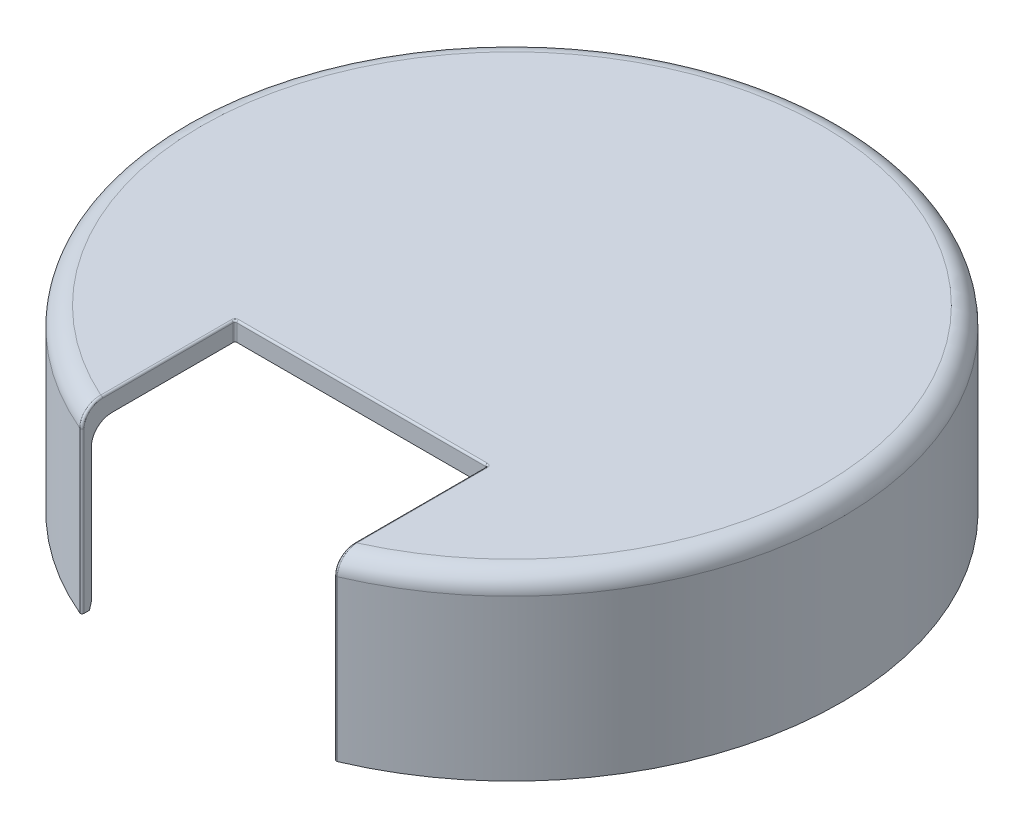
SolidWorks part; units mm, degrees
ref_plane "Front Plane" through (0, 0, 0) normal (0, 0, 1) x (1, 0, 0)
ref_plane "Top Plane" through (0, 0, 0) normal (0, 1, 0) x (1, 0, 0)
ref_plane "Right Plane" through (0, 0, 0) normal (1, 0, 0) x (0, 0, -1)
sketch "Sketch1" plane through (0, 0, 0) normal (0, 1, 0) x (1, 0, 0)
  circle A0 centre (0, 0) radius 17.5
  dimension "D1" = 35
extrude "Boss-Extrude1" add sketch "Sketch1" along normal blind 9.5
sketch "Sketch2" plane through (0, 0, 0) normal (0, -1, 0) x (1, 0, 0)
  circle A0 centre (0, 0) radius 17
  dimension "D1" = 34
extrude "Cut-Extrude1" cut sketch "Sketch2" against normal blind 8.5
fillet "Fillet1" radius 1 2 edges at (0, 9.5, 17.5) (0, 8.5, -17)
sketch "Sketch4" plane through (0, 0, 0) normal (0, 0, 1) x (1, 0, 0)
  line L0 (-17.5, 0) -> (17.5, 0) construction
  line L1 (-17.0328, 0) -> (-17.4451, 0)
  line L2 (17.4451, 1.5548) -> (16.8, 1.32)
  line L3 (16.8, 1.32) -> (17.0328, 0)
  line L6 (17.4451, 0) -> (17.4451, 1.5548)
  line L8 (17.0328, 0) -> (17.4451, 0)
  line L9 (0, 0) -> (0, 4.2931) construction
  line L10 (-17.4451, 0) -> (-17.4451, 1.5548)
  line L12 (-16.8, 1.32) -> (-17.0328, 0)
  line L13 (-17.4451, 1.5548) -> (-16.8, 1.32)
  dimension "D5" = 90
  dimension "D1" = 10
  dimension "D2" = 20
  dimension "D3" = 1.32
  dimension "D4" = 16.8
revolve "Revolve3" add sketch "Sketch4" angle 24 mid plane about L9
sketch "Sketch3" plane through (0, 9.5, 0) normal (0, 1, 0) x (1, 0, 0)
  line L1 (-6.6, -8) -> (6.6, -8)
  line L2 (-6.7, -8.1) -> (-6.7, -20.5992)
  line L3 (-6.7, -20.5992) -> (6.7, -20.5992)
  line L4 (6.7, -8.1) -> (6.7, -20.5992)
  circle A0 centre (0, 0) radius 17.5 construction
  arc A1 (6.6, -8) -> (6.7, -8.1) centre (6.6, -8.1) cw
  arc A2 (-6.6, -8) -> (-6.7, -8.1) centre (-6.6, -8.1) ccw
  dimension "D1" = 8
  dimension "D4" = 0.1
  dimension "D2" = 6.7
  dimension "D3" = 6.7
extrude "Cut-Extrude2" cut sketch "Sketch3" against normal blind 11
sketch "Sketch5" plane through (0, 9.5, 0) normal (0, 1, 0) x (1, 0, 0)
  line L1 (-9, 6) -> (9, 6)
  line L2 (-10, 5) -> (-10, -1)
  line L3 (-9, -2) -> (9, -2)
  line L4 (10, 5) -> (10, -1)
  arc A0 (9, -2) -> (10, -1) centre (9, -1) ccw
  arc A1 (10, 5) -> (9, 6) centre (9, 5) ccw
  arc A2 (-10, 5) -> (-9, 6) centre (-9, 5) cw
  arc A3 (-9, -2) -> (-10, -1) centre (-9, -1) cw
  dimension "D5" = 1
  dimension "D1" = 10
  dimension "D2" = 10
  dimension "D3" = 2
  dimension "D4" = 6
extrude "Cut-Extrude3" [suppressed] cut sketch "Sketch5" against normal blind 0.1
chamfer "Chamfer2" distance 0.1 angle 75 1 edges at (0, 0, -17)
fillet "Fillet2" radius 0.1 9 edges at (6.7, 8.9632, 16.0434) (6.7, 9.5, 11.5892) (6.6707, 9.5, 8.0293) (0, 9.5, 8) (-6.6707, 9.5, 8.0293) (-6.7, 9.5, 11.5892) (-6.7, 9.1468, 15.9094) (6.7, 4.25, 16.1666) (-6.7, 4.25, 16.1666)
sketch "Sketch6" [suppressed] plane through (0, 9.4, 0) normal (0, 1, 0) x (1, 0, 0)
  line L0 (1.1294, -0.1549) -> (1.1294, 3.8449)
  line L1 (1.1294, 3.8449) -> (2.6002, 3.8449)
  line L2 (2.6002, 3.8449) -> (2.6002, 1.1427)
  line L3 (2.6002, 1.1427) -> (4.0281, 1.1427)
  line L4 (4.0281, 1.1427) -> (4.0281, -0.1549)
  line L5 (4.0281, -0.1549) -> (1.1294, -0.1549)
  line L6 (-5.272, 1.3002) -> (-4.1097, 2.4626)
  line L7 (-4.1097, 2.4626) -> (-4.1028, 2.4704)
  line L8 (-4.1028, 2.4704) -> (-4.096, 2.4782)
  line L9 (-4.096, 2.4782) -> (-4.0892, 2.486)
  line L10 (-4.0892, 2.486) -> (-4.0834, 2.4947)
  line L11 (-4.0834, 2.4947) -> (-4.0727, 2.5122)
  line L12 (-4.0727, 2.5122) -> (-4.0639, 2.5298)
  line L13 (-4.0639, 2.5298) -> (-4.0571, 2.5482)
  line L14 (-4.0571, 2.5482) -> (-4.0523, 2.5667)
  line L15 (-4.0523, 2.5667) -> (-4.0484, 2.5862)
  line L16 (-4.0484, 2.5862) -> (-4.0474, 2.6047)
  line L17 (-4.0474, 2.6047) -> (-4.0474, 2.6241)
  line L18 (-4.0474, 2.6241) -> (-4.0493, 2.6426)
  line L19 (-4.0493, 2.6426) -> (-4.0532, 2.6611)
  line L20 (-4.0532, 2.6611) -> (-4.0591, 2.6786)
  line L21 (-4.0591, 2.6786) -> (-4.063, 2.6873)
  line L22 (-4.063, 2.6873) -> (-4.0669, 2.6961)
  line L23 (-4.0669, 2.6961) -> (-4.0717, 2.7048)
  line L24 (-4.0717, 2.7048) -> (-4.0766, 2.7126)
  line L25 (-4.0766, 2.7126) -> (-4.0814, 2.7204)
  line L26 (-4.0814, 2.7204) -> (-4.0873, 2.7282)
  line L27 (-4.0873, 2.7282) -> (-4.0941, 2.736)
  line L28 (-4.0941, 2.736) -> (-4.1009, 2.7428)
  line L29 (-4.1009, 2.7428) -> (-4.1272, 2.77)
  line L30 (-4.1272, 2.77) -> (-4.134, 2.7768)
  line L31 (-4.134, 2.7768) -> (-4.1418, 2.7827)
  line L32 (-4.1418, 2.7827) -> (-4.1495, 2.7885)
  line L33 (-4.1495, 2.7885) -> (-4.1573, 2.7943)
  line L34 (-4.1573, 2.7943) -> (-4.1661, 2.7992)
  line L35 (-4.1661, 2.7992) -> (-4.1739, 2.8031)
  line L36 (-4.1739, 2.8031) -> (-4.1826, 2.807)
  line L37 (-4.1826, 2.807) -> (-4.1914, 2.8109)
  line L38 (-4.1914, 2.8109) -> (-4.2089, 2.8167)
  line L39 (-4.2089, 2.8167) -> (-4.2274, 2.8206)
  line L40 (-4.2274, 2.8206) -> (-4.2468, 2.8225)
  line L41 (-4.2468, 2.8225) -> (-4.2653, 2.8235)
  line L42 (-4.2653, 2.8235) -> (-4.2847, 2.8216)
  line L43 (-4.2847, 2.8216) -> (-4.3032, 2.8187)
  line L44 (-4.3032, 2.8187) -> (-4.3227, 2.8128)
  line L45 (-4.3227, 2.8128) -> (-4.3402, 2.806)
  line L46 (-4.3402, 2.806) -> (-4.3587, 2.7973)
  line L47 (-4.3587, 2.7973) -> (-4.3752, 2.7866)
  line L48 (-4.3752, 2.7866) -> (-4.384, 2.7807)
  line L49 (-4.384, 2.7807) -> (-4.3917, 2.7749)
  line L50 (-4.3917, 2.7749) -> (-4.3995, 2.7681)
  line L51 (-4.3995, 2.7681) -> (-4.4073, 2.7603)
  line L52 (-4.4073, 2.7603) -> (-4.6155, 2.5531)
  line L53 (-4.6155, 2.5531) -> (-5.0104, 2.948)
  line L54 (-5.0104, 2.948) -> (-5.023, 2.9607)
  line L55 (-5.023, 2.9607) -> (-5.0357, 2.9743)
  line L56 (-5.0357, 2.9743) -> (-5.0863, 3.0219)
  line L57 (-5.0863, 3.0219) -> (-5.1378, 3.0667)
  line L58 (-5.1378, 3.0667) -> (-5.1923, 3.1085)
  line L59 (-5.1923, 3.1085) -> (-5.2477, 3.1465)
  line L60 (-5.2477, 3.1465) -> (-5.3041, 3.1824)
  line L61 (-5.3041, 3.1824) -> (-5.3625, 3.2145)
  line L62 (-5.3625, 3.2145) -> (-5.4218, 3.2437)
  line L63 (-5.4218, 3.2437) -> (-5.4822, 3.27)
  line L64 (-5.4822, 3.27) -> (-5.5444, 3.2933)
  line L65 (-5.5444, 3.2933) -> (-5.6067, 3.3138)
  line L66 (-5.6067, 3.3138) -> (-5.6689, 3.3303)
  line L67 (-5.6689, 3.3303) -> (-5.7331, 3.3439)
  line L68 (-5.7331, 3.3439) -> (-5.7973, 3.3556)
  line L69 (-5.7973, 3.3556) -> (-5.8615, 3.3634)
  line L70 (-5.8615, 3.3634) -> (-5.9267, 3.3673)
  line L71 (-5.9267, 3.3673) -> (-5.9919, 3.3692)
  line L72 (-5.9919, 3.3692) -> (-6.0561, 3.3673)
  line L73 (-6.0561, 3.3673) -> (-6.1212, 3.3634)
  line L74 (-6.1212, 3.3634) -> (-6.1854, 3.3556)
  line L75 (-6.1854, 3.3556) -> (-6.2496, 3.3449)
  line L76 (-6.2496, 3.3449) -> (-6.3138, 3.3313)
  line L77 (-6.3138, 3.3313) -> (-6.3771, 3.3138)
  line L78 (-6.3771, 3.3138) -> (-6.4393, 3.2943)
  line L79 (-6.4393, 3.2943) -> (-6.5006, 3.271)
  line L80 (-6.5006, 3.271) -> (-6.5609, 3.2447)
  line L81 (-6.5609, 3.2447) -> (-6.6202, 3.2155)
  line L82 (-6.6202, 3.2155) -> (-6.6786, 3.1834)
  line L83 (-6.6786, 3.1834) -> (-6.736, 3.1484)
  line L84 (-6.736, 3.1484) -> (-6.7914, 3.1095)
  line L85 (-6.7914, 3.1095) -> (-6.8449, 3.0677)
  line L86 (-6.8449, 3.0677) -> (-6.8975, 3.0229)
  line L87 (-6.8975, 3.0229) -> (-6.9471, 2.9753)
  line L88 (-6.9471, 2.9753) -> (-6.9957, 2.9257)
  line L89 (-6.9957, 2.9257) -> (-7.0395, 2.8731)
  line L90 (-7.0395, 2.8731) -> (-7.0813, 2.8196)
  line L91 (-7.0813, 2.8196) -> (-7.1202, 2.7642)
  line L92 (-7.1202, 2.7642) -> (-7.1552, 2.7068)
  line L93 (-7.1552, 2.7068) -> (-7.1873, 2.6484)
  line L94 (-7.1873, 2.6484) -> (-7.2165, 2.5891)
  line L95 (-7.2165, 2.5891) -> (-7.2428, 2.5288)
  line L96 (-7.2428, 2.5288) -> (-7.2661, 2.4675)
  line L97 (-7.2661, 2.4675) -> (-7.2856, 2.4043)
  line L98 (-7.2856, 2.4043) -> (-7.3031, 2.342)
  line L99 (-7.3031, 2.342) -> (-7.3167, 2.2778)
  line L100 (-7.3167, 2.2778) -> (-7.3274, 2.2136)
  line L101 (-7.3274, 2.2136) -> (-7.3352, 2.1494)
  line L102 (-7.3352, 2.1494) -> (-7.34, 2.0842)
  line L103 (-7.34, 2.0842) -> (-7.341, 2.0191)
  line L104 (-7.341, 2.0191) -> (-7.3391, 1.9549)
  line L105 (-7.3391, 1.9549) -> (-7.3352, 1.8897)
  line L106 (-7.3352, 1.8897) -> (-7.3274, 1.8255)
  line L107 (-7.3274, 1.8255) -> (-7.3157, 1.7613)
  line L108 (-7.3157, 1.7613) -> (-7.3021, 1.6971)
  line L109 (-7.3021, 1.6971) -> (-7.2856, 1.6339)
  line L110 (-7.2856, 1.6339) -> (-7.2651, 1.5716)
  line L111 (-7.2651, 1.5716) -> (-7.2418, 1.5103)
  line L112 (-7.2418, 1.5103) -> (-7.2155, 1.45)
  line L113 (-7.2155, 1.45) -> (-7.1864, 1.3907)
  line L114 (-7.1864, 1.3907) -> (-7.1543, 1.3323)
  line L115 (-7.1543, 1.3323) -> (-7.1183, 1.2759)
  line L116 (-7.1183, 1.2759) -> (-7.0803, 1.2205)
  line L117 (-7.0803, 1.2205) -> (-7.0385, 1.166)
  line L118 (-7.0385, 1.166) -> (-6.9938, 1.1144)
  line L119 (-6.9938, 1.1144) -> (-6.9461, 1.0639)
  line L120 (-6.9461, 1.0639) -> (-6.9325, 1.0512)
  line L121 (-6.9325, 1.0512) -> (-6.9198, 1.0386)
  line L122 (-6.9198, 1.0386) -> (-6.5249, 0.6437)
  line L123 (-6.5249, 0.6437) -> (-6.7331, 0.4355)
  line L124 (-6.7331, 0.4355) -> (-6.7399, 0.4277)
  line L125 (-6.7399, 0.4277) -> (-6.7467, 0.4199)
  line L126 (-6.7467, 0.4199) -> (-6.7525, 0.4121)
  line L127 (-6.7525, 0.4121) -> (-6.7593, 0.4034)
  line L128 (-6.7593, 0.4034) -> (-6.7691, 0.3869)
  line L129 (-6.7691, 0.3869) -> (-6.7778, 0.3684)
  line L130 (-6.7778, 0.3684) -> (-6.7846, 0.3499)
  line L131 (-6.7846, 0.3499) -> (-6.7905, 0.3314)
  line L132 (-6.7905, 0.3314) -> (-6.7934, 0.3129)
  line L133 (-6.7934, 0.3129) -> (-6.7953, 0.2935)
  line L134 (-6.7953, 0.2935) -> (-6.7944, 0.274)
  line L135 (-6.7944, 0.274) -> (-6.7924, 0.2555)
  line L136 (-6.7924, 0.2555) -> (-6.7885, 0.2371)
  line L137 (-6.7885, 0.2371) -> (-6.7827, 0.2195)
  line L138 (-6.7827, 0.2195) -> (-6.7798, 0.2108)
  line L139 (-6.7798, 0.2108) -> (-6.7749, 0.202)
  line L140 (-6.7749, 0.202) -> (-6.771, 0.1933)
  line L141 (-6.771, 0.1933) -> (-6.7661, 0.1855)
  line L142 (-6.7661, 0.1855) -> (-6.7603, 0.1777)
  line L143 (-6.7603, 0.1777) -> (-6.7545, 0.1699)
  line L144 (-6.7545, 0.1699) -> (-6.7486, 0.1622)
  line L145 (-6.7486, 0.1622) -> (-6.7418, 0.1553)
  line L146 (-6.7418, 0.1553) -> (-6.7146, 0.1281)
  line L147 (-6.7146, 0.1281) -> (-6.7078, 0.1213)
  line L148 (-6.7078, 0.1213) -> (-6.7, 0.1155)
  line L149 (-6.7, 0.1155) -> (-6.6922, 0.1096)
  line L150 (-6.6922, 0.1096) -> (-6.6844, 0.1038)
  line L151 (-6.6844, 0.1038) -> (-6.6767, 0.0989)
  line L152 (-6.6767, 0.0989) -> (-6.6679, 0.095)
  line L153 (-6.6679, 0.095) -> (-6.6601, 0.0911)
  line L154 (-6.6601, 0.0911) -> (-6.6504, 0.0873)
  line L155 (-6.6504, 0.0873) -> (-6.6329, 0.0814)
  line L156 (-6.6329, 0.0814) -> (-6.6144, 0.0775)
  line L157 (-6.6144, 0.0775) -> (-6.5959, 0.0756)
  line L158 (-6.5959, 0.0756) -> (-6.5765, 0.0756)
  line L159 (-6.5765, 0.0756) -> (-6.558, 0.0766)
  line L160 (-6.558, 0.0766) -> (-6.5385, 0.0804)
  line L161 (-6.5385, 0.0804) -> (-6.52, 0.0853)
  line L162 (-6.52, 0.0853) -> (-6.5016, 0.0921)
  line L163 (-6.5016, 0.0921) -> (-6.4841, 0.1009)
  line L164 (-6.4841, 0.1009) -> (-6.4665, 0.1116)
  line L165 (-6.4665, 0.1116) -> (-6.4588, 0.1174)
  line L166 (-6.4588, 0.1174) -> (-6.45, 0.1232)
  line L167 (-6.45, 0.1232) -> (-6.4422, 0.1301)
  line L168 (-6.4422, 0.1301) -> (-6.4344, 0.1378)
  line L169 (-6.4344, 0.1378) -> (-5.272, 1.3002)
  line L170 (-7.6163, 3.8449) -> (-4.0163, 3.8449)
  line L171 (-4.0163, 3.8449) -> (-4.0065, 3.8449)
  line L172 (-4.0065, 3.8449) -> (-3.9958, 3.8439)
  line L173 (-3.9958, 3.8439) -> (-3.9861, 3.8429)
  line L174 (-3.9861, 3.8429) -> (-3.9764, 3.841)
  line L175 (-3.9764, 3.841) -> (-3.9569, 3.8361)
  line L176 (-3.9569, 3.8361) -> (-3.9394, 3.8293)
  line L177 (-3.9394, 3.8293) -> (-3.9219, 3.8206)
  line L178 (-3.9219, 3.8206) -> (-3.9054, 3.8108)
  line L179 (-3.9054, 3.8108) -> (-3.8898, 3.7992)
  line L180 (-3.8898, 3.7992) -> (-3.8752, 3.7865)
  line L181 (-3.8752, 3.7865) -> (-3.8626, 3.7719)
  line L182 (-3.8626, 3.7719) -> (-3.8509, 3.7564)
  line L183 (-3.8509, 3.7564) -> (-3.8412, 3.7398)
  line L184 (-3.8412, 3.7398) -> (-3.8324, 3.7223)
  line L185 (-3.8324, 3.7223) -> (-3.8256, 3.7038)
  line L186 (-3.8256, 3.7038) -> (-3.8208, 3.6853)
  line L187 (-3.8208, 3.6853) -> (-3.8188, 3.6756)
  line L188 (-3.8188, 3.6756) -> (-3.8178, 3.6649)
  line L189 (-3.8178, 3.6649) -> (-3.8169, 3.6552)
  line L190 (-3.8169, 3.6552) -> (-3.8169, 3.6445)
  line L191 (-3.8169, 3.6445) -> (-3.8169, 0.0445)
  line L192 (-3.8169, 0.0445) -> (-3.8169, 0.0347)
  line L193 (-3.8169, 0.0347) -> (-3.8178, 0.024)
  line L194 (-3.8178, 0.024) -> (-3.8188, 0.0143)
  line L195 (-3.8188, 0.0143) -> (-3.8208, 0.0046)
  line L196 (-3.8208, 0.0046) -> (-3.8227, -0.0051)
  line L197 (-3.8227, -0.0051) -> (-3.8256, -0.0149)
  line L198 (-3.8256, -0.0149) -> (-3.8285, -0.0236)
  line L199 (-3.8285, -0.0236) -> (-3.8324, -0.0334)
  line L200 (-3.8324, -0.0334) -> (-3.8412, -0.0509)
  line L201 (-3.8412, -0.0509) -> (-3.8509, -0.0674)
  line L202 (-3.8509, -0.0674) -> (-3.8626, -0.082)
  line L203 (-3.8626, -0.082) -> (-3.8752, -0.0966)
  line L204 (-3.8752, -0.0966) -> (-3.8898, -0.1092)
  line L205 (-3.8898, -0.1092) -> (-3.9054, -0.1209)
  line L206 (-3.9054, -0.1209) -> (-3.9219, -0.1316)
  line L207 (-3.9219, -0.1316) -> (-3.9394, -0.1394)
  line L208 (-3.9394, -0.1394) -> (-3.9482, -0.1433)
  line L209 (-3.9482, -0.1433) -> (-3.9569, -0.1462)
  line L210 (-3.9569, -0.1462) -> (-3.9667, -0.1491)
  line L211 (-3.9667, -0.1491) -> (-3.9764, -0.1511)
  line L212 (-3.9764, -0.1511) -> (-3.9861, -0.153)
  line L213 (-3.9861, -0.153) -> (-3.9958, -0.154)
  line L214 (-3.9958, -0.154) -> (-4.0065, -0.1549)
  line L215 (-4.0065, -0.1549) -> (-4.0163, -0.1549)
  line L216 (-4.0163, -0.1549) -> (-7.6163, -0.1549)
  line L217 (-7.6163, -0.1549) -> (-7.627, -0.1549)
  line L218 (-7.627, -0.1549) -> (-7.6367, -0.154)
  line L219 (-7.6367, -0.154) -> (-7.6474, -0.153)
  line L220 (-7.6474, -0.153) -> (-7.6572, -0.1511)
  line L221 (-7.6572, -0.1511) -> (-7.6669, -0.1491)
  line L222 (-7.6669, -0.1491) -> (-7.6756, -0.1462)
  line L223 (-7.6756, -0.1462) -> (-7.6854, -0.1433)
  line L224 (-7.6854, -0.1433) -> (-7.6941, -0.1394)
  line L225 (-7.6941, -0.1394) -> (-7.7116, -0.1316)
  line L226 (-7.7116, -0.1316) -> (-7.7282, -0.1209)
  line L227 (-7.7282, -0.1209) -> (-7.7437, -0.1092)
  line L228 (-7.7437, -0.1092) -> (-7.7583, -0.0966)
  line L229 (-7.7583, -0.0966) -> (-7.771, -0.082)
  line L230 (-7.771, -0.082) -> (-7.7826, -0.0674)
  line L231 (-7.7826, -0.0674) -> (-7.7924, -0.0509)
  line L232 (-7.7924, -0.0509) -> (-7.8011, -0.0334)
  line L233 (-7.8011, -0.0334) -> (-7.805, -0.0236)
  line L234 (-7.805, -0.0236) -> (-7.8079, -0.0149)
  line L235 (-7.8079, -0.0149) -> (-7.8108, -0.0051)
  line L236 (-7.8108, -0.0051) -> (-7.8128, 0.0046)
  line L237 (-7.8128, 0.0046) -> (-7.8147, 0.0143)
  line L238 (-7.8147, 0.0143) -> (-7.8157, 0.024)
  line L239 (-7.8157, 0.024) -> (-7.8167, 0.0347)
  line L240 (-7.8167, 0.0347) -> (-7.8167, 0.0445)
  line L241 (-7.8167, 0.0445) -> (-7.8167, 3.6445)
  line L242 (-7.8167, 3.6445) -> (-7.8167, 3.6552)
  line L243 (-7.8167, 3.6552) -> (-7.8157, 3.6649)
  line L244 (-7.8157, 3.6649) -> (-7.8147, 3.6756)
  line L245 (-7.8147, 3.6756) -> (-7.8128, 3.6853)
  line L246 (-7.8128, 3.6853) -> (-7.8108, 3.6951)
  line L247 (-7.8108, 3.6951) -> (-7.8079, 3.7038)
  line L248 (-7.8079, 3.7038) -> (-7.805, 3.7136)
  line L249 (-7.805, 3.7136) -> (-7.8011, 3.7223)
  line L250 (-7.8011, 3.7223) -> (-7.7924, 3.7398)
  line L251 (-7.7924, 3.7398) -> (-7.7826, 3.7564)
  line L252 (-7.7826, 3.7564) -> (-7.771, 3.7719)
  line L253 (-7.771, 3.7719) -> (-7.7583, 3.7865)
  line L254 (-7.7583, 3.7865) -> (-7.7437, 3.7992)
  line L255 (-7.7437, 3.7992) -> (-7.7282, 3.8108)
  line L256 (-7.7282, 3.8108) -> (-7.7116, 3.8206)
  line L257 (-7.7116, 3.8206) -> (-7.6941, 3.8293)
  line L258 (-7.6941, 3.8293) -> (-7.6854, 3.8322)
  line L259 (-7.6854, 3.8322) -> (-7.6756, 3.8361)
  line L260 (-7.6756, 3.8361) -> (-7.6669, 3.8381)
  line L261 (-7.6669, 3.8381) -> (-7.6572, 3.841)
  line L262 (-7.6572, 3.841) -> (-7.6474, 3.8429)
  line L263 (-7.6474, 3.8429) -> (-7.6367, 3.8439)
  line L264 (-7.6367, 3.8439) -> (-7.627, 3.8449)
  line L265 (-7.627, 3.8449) -> (-7.6163, 3.8449)
  line L266 (-2.9599, -0.1549) -> (-2.9599, 3.8449)
  line L267 (-2.9599, 3.8449) -> (-1.1127, 3.8449)
  line L268 (-1.1127, 3.8449) -> (-1.0631, 3.8449)
  line L269 (-1.0631, 3.8449) -> (-1.0135, 3.8439)
  line L270 (-1.0135, 3.8439) -> (-0.9649, 3.842)
  line L271 (-0.9649, 3.842) -> (-0.9172, 3.839)
  line L272 (-0.9172, 3.839) -> (-0.8705, 3.8361)
  line L273 (-0.8705, 3.8361) -> (-0.8248, 3.8322)
  line L274 (-0.8248, 3.8322) -> (-0.7791, 3.8283)
  line L275 (-0.7791, 3.8283) -> (-0.7343, 3.8235)
  line L276 (-0.7343, 3.8235) -> (-0.6905, 3.8176)
  line L277 (-0.6905, 3.8176) -> (-0.6477, 3.8108)
  line L278 (-0.6477, 3.8108) -> (-0.6049, 3.804)
  line L279 (-0.6049, 3.804) -> (-0.5631, 3.7962)
  line L280 (-0.5631, 3.7962) -> (-0.5223, 3.7875)
  line L281 (-0.5223, 3.7875) -> (-0.4824, 3.7787)
  line L282 (-0.4824, 3.7787) -> (-0.4425, 3.769)
  line L283 (-0.4425, 3.769) -> (-0.4046, 3.7583)
  line L284 (-0.4046, 3.7583) -> (-0.3666, 3.7466)
  line L285 (-0.3666, 3.7466) -> (-0.3287, 3.735)
  line L286 (-0.3287, 3.735) -> (-0.2927, 3.7223)
  line L287 (-0.2927, 3.7223) -> (-0.2567, 3.7097)
  line L288 (-0.2567, 3.7097) -> (-0.2217, 3.6951)
  line L289 (-0.2217, 3.6951) -> (-0.1877, 3.6805)
  line L290 (-0.1877, 3.6805) -> (-0.1536, 3.6659)
  line L291 (-0.1536, 3.6659) -> (-0.1205, 3.6494)
  line L292 (-0.1205, 3.6494) -> (-0.0884, 3.6328)
  line L293 (-0.0884, 3.6328) -> (-0.0573, 3.6153)
  line L294 (-0.0573, 3.6153) -> (-0.0272, 3.5978)
  line L295 (-0.0272, 3.5978) -> (0.003, 3.5793)
  line L296 (0.003, 3.5793) -> (0.0322, 3.5599)
  line L297 (0.0322, 3.5599) -> (0.0604, 3.5394)
  line L298 (0.0604, 3.5394) -> (0.0876, 3.519)
  line L299 (0.0876, 3.519) -> (0.1149, 3.4976)
  line L300 (0.1149, 3.4976) -> (0.1411, 3.4762)
  line L301 (0.1411, 3.4762) -> (0.1664, 3.4529)
  line L302 (0.1664, 3.4529) -> (0.1907, 3.4305)
  line L303 (0.1907, 3.4305) -> (0.2141, 3.4062)
  line L304 (0.2141, 3.4062) -> (0.2374, 3.3819)
  line L305 (0.2374, 3.3819) -> (0.2588, 3.3566)
  line L306 (0.2588, 3.3566) -> (0.2802, 3.3313)
  line L307 (0.2802, 3.3313) -> (0.3007, 3.305)
  line L308 (0.3007, 3.305) -> (0.3201, 3.2787)
  line L309 (0.3201, 3.2787) -> (0.3386, 3.2505)
  line L310 (0.3386, 3.2505) -> (0.3561, 3.2233)
  line L311 (0.3561, 3.2233) -> (0.3736, 3.1941)
  line L312 (0.3736, 3.1941) -> (0.3892, 3.1649)
  line L313 (0.3892, 3.1649) -> (0.4047, 3.1358)
  line L314 (0.4047, 3.1358) -> (0.4193, 3.1056)
  line L315 (0.4193, 3.1056) -> (0.4329, 3.0745)
  line L316 (0.4329, 3.0745) -> (0.4456, 3.0424)
  line L317 (0.4456, 3.0424) -> (0.4573, 3.0103)
  line L318 (0.4573, 3.0103) -> (0.4689, 2.9782)
  line L319 (0.4689, 2.9782) -> (0.4787, 2.9441)
  line L320 (0.4787, 2.9441) -> (0.4884, 2.9101)
  line L321 (0.4884, 2.9101) -> (0.4971, 2.876)
  line L322 (0.4971, 2.876) -> (0.5049, 2.841)
  line L323 (0.5049, 2.841) -> (0.5117, 2.805)
  line L324 (0.5117, 2.805) -> (0.5185, 2.769)
  line L325 (0.5185, 2.769) -> (0.5234, 2.7321)
  line L326 (0.5234, 2.7321) -> (0.5283, 2.6941)
  line L327 (0.5283, 2.6941) -> (0.5322, 2.6562)
  line L328 (0.5322, 2.6562) -> (0.5351, 2.6173)
  line L329 (0.5351, 2.6173) -> (0.537, 2.5784)
  line L330 (0.537, 2.5784) -> (0.538, 2.5385)
  line L331 (0.538, 2.5385) -> (0.539, 2.4977)
  line L332 (0.539, 2.4977) -> (0.538, 2.4451)
  line L333 (0.538, 2.4451) -> (0.5351, 2.3936)
  line L334 (0.5351, 2.3936) -> (0.5312, 2.343)
  line L335 (0.5312, 2.343) -> (0.5254, 2.2944)
  line L336 (0.5254, 2.2944) -> (0.5176, 2.2457)
  line L337 (0.5176, 2.2457) -> (0.5088, 2.199)
  line L338 (0.5088, 2.199) -> (0.4971, 2.1533)
  line L339 (0.4971, 2.1533) -> (0.4855, 2.1095)
  line L340 (0.4855, 2.1095) -> (0.4709, 2.0658)
  line L341 (0.4709, 2.0658) -> (0.4553, 2.0239)
  line L342 (0.4553, 2.0239) -> (0.4466, 2.0035)
  line L343 (0.4466, 2.0035) -> (0.4378, 1.9831)
  line L344 (0.4378, 1.9831) -> (0.4281, 1.9627)
  line L345 (0.4281, 1.9627) -> (0.4184, 1.9432)
  line L346 (0.4184, 1.9432) -> (0.4086, 1.9238)
  line L347 (0.4086, 1.9238) -> (0.3979, 1.9043)
  line L348 (0.3979, 1.9043) -> (0.3863, 1.8858)
  line L349 (0.3863, 1.8858) -> (0.3756, 1.8673)
  line L350 (0.3756, 1.8673) -> (0.3629, 1.8489)
  line L351 (0.3629, 1.8489) -> (0.3512, 1.8304)
  line L352 (0.3512, 1.8304) -> (0.3386, 1.8129)
  line L353 (0.3386, 1.8129) -> (0.325, 1.7954)
  line L354 (0.325, 1.7954) -> (0.3114, 1.7788)
  line L355 (0.3114, 1.7788) -> (0.2977, 1.7623)
  line L356 (0.2977, 1.7623) -> (0.2841, 1.7457)
  line L357 (0.2841, 1.7457) -> (0.2695, 1.7302)
  line L358 (0.2695, 1.7302) -> (0.2549, 1.7146)
  line L359 (0.2549, 1.7146) -> (0.2394, 1.7)
  line L360 (0.2394, 1.7) -> (0.2248, 1.6854)
  line L361 (0.2248, 1.6854) -> (0.2092, 1.6718)
  line L362 (0.2092, 1.6718) -> (0.1937, 1.6582)
  line L363 (0.1937, 1.6582) -> (0.1771, 1.6456)
  line L364 (0.1771, 1.6456) -> (0.1606, 1.6329)
  line L365 (0.1606, 1.6329) -> (0.144, 1.6203)
  line L366 (0.144, 1.6203) -> (0.1265, 1.6086)
  line L367 (0.1265, 1.6086) -> (0.11, 1.5979)
  line L368 (0.11, 1.5979) -> (0.0925, 1.5872)
  line L369 (0.0925, 1.5872) -> (0.074, 1.5765)
  line L370 (0.074, 1.5765) -> (0.0565, 1.5668)
  line L371 (0.0565, 1.5668) -> (0.038, 1.557)
  line L372 (0.038, 1.557) -> (0.0195, 1.5483)
  line L373 (0.0195, 1.5483) -> (0.0001, 1.5395)
  line L374 (0.0001, 1.5395) -> (-0.0194, 1.5317)
  line L375 (-0.0194, 1.5317) -> (-0.0388, 1.524)
  line L376 (-0.0388, 1.524) -> (-0.0583, 1.5172)
  line L377 (-0.0583, 1.5172) -> (-0.0787, 1.5103)
  line L378 (-0.0787, 1.5103) -> (-0.0991, 1.5045)
  line L379 (-0.0991, 1.5045) -> (-0.1205, 1.4987)
  line L380 (-0.1205, 1.4987) -> (-0.141, 1.4928)
  line L381 (-0.141, 1.4928) -> (-0.1624, 1.488)
  line L382 (-0.1624, 1.488) -> (-0.1838, 1.4841)
  line L383 (-0.1838, 1.4841) -> (-0.2061, 1.4792)
  line L384 (-0.2061, 1.4792) -> (-0.2285, 1.4763)
  line L385 (-0.2285, 1.4763) -> (-0.2509, 1.4734)
  line L386 (-0.2509, 1.4734) -> (0.8395, -0.1549)
  line L387 (0.8395, -0.1549) -> (-0.8053, -0.1549)
  line L388 (-0.8053, -0.1549) -> (-1.5203, 1.1641)
  line L389 (-1.5203, 1.1641) -> (-1.5203, -0.1549)
  line L390 (-1.5203, -0.1549) -> (-2.9599, -0.1549)
  line L391 (-1.5203, 2.8148) -> (-1.5203, 2.0337)
  line L392 (-1.5203, 2.0337) -> (-1.2917, 2.0337)
  line L393 (-1.2917, 2.0337) -> (-1.2654, 2.0337)
  line L394 (-1.2654, 2.0337) -> (-1.2401, 2.0356)
  line L395 (-1.2401, 2.0356) -> (-1.2158, 2.0376)
  line L396 (-1.2158, 2.0376) -> (-1.1925, 2.0395)
  line L397 (-1.1925, 2.0395) -> (-1.1701, 2.0434)
  line L398 (-1.1701, 2.0434) -> (-1.1477, 2.0473)
  line L399 (-1.1477, 2.0473) -> (-1.1263, 2.0531)
  line L400 (-1.1263, 2.0531) -> (-1.1059, 2.059)
  line L401 (-1.1059, 2.059) -> (-1.0864, 2.0648)
  line L402 (-1.0864, 2.0648) -> (-1.068, 2.0726)
  line L403 (-1.068, 2.0726) -> (-1.0495, 2.0813)
  line L404 (-1.0495, 2.0813) -> (-1.032, 2.0901)
  line L405 (-1.032, 2.0901) -> (-1.0154, 2.0998)
  line L406 (-1.0154, 2.0998) -> (-0.9989, 2.1105)
  line L407 (-0.9989, 2.1105) -> (-0.9843, 2.1212)
  line L408 (-0.9843, 2.1212) -> (-0.9697, 2.1329)
  line L409 (-0.9697, 2.1329) -> (-0.9561, 2.1465)
  line L410 (-0.9561, 2.1465) -> (-0.9435, 2.1591)
  line L411 (-0.9435, 2.1591) -> (-0.9308, 2.1737)
  line L412 (-0.9308, 2.1737) -> (-0.9201, 2.1883)
  line L413 (-0.9201, 2.1883) -> (-0.9104, 2.2039)
  line L414 (-0.9104, 2.2039) -> (-0.9007, 2.2204)
  line L415 (-0.9007, 2.2204) -> (-0.8919, 2.237)
  line L416 (-0.8919, 2.237) -> (-0.8851, 2.2545)
  line L417 (-0.8851, 2.2545) -> (-0.8783, 2.273)
  line L418 (-0.8783, 2.273) -> (-0.8724, 2.2914)
  line L419 (-0.8724, 2.2914) -> (-0.8676, 2.3109)
  line L420 (-0.8676, 2.3109) -> (-0.8637, 2.3313)
  line L421 (-0.8637, 2.3313) -> (-0.8608, 2.3517)
  line L422 (-0.8608, 2.3517) -> (-0.8579, 2.3731)
  line L423 (-0.8579, 2.3731) -> (-0.8569, 2.3955)
  line L424 (-0.8569, 2.3955) -> (-0.8559, 2.4189)
  line L425 (-0.8559, 2.4189) -> (-0.8569, 2.4422)
  line L426 (-0.8569, 2.4422) -> (-0.8579, 2.4656)
  line L427 (-0.8579, 2.4656) -> (-0.8608, 2.4879)
  line L428 (-0.8608, 2.4879) -> (-0.8637, 2.5093)
  line L429 (-0.8637, 2.5093) -> (-0.8676, 2.5298)
  line L430 (-0.8676, 2.5298) -> (-0.8724, 2.5502)
  line L431 (-0.8724, 2.5502) -> (-0.8783, 2.5696)
  line L432 (-0.8783, 2.5696) -> (-0.8851, 2.5881)
  line L433 (-0.8851, 2.5881) -> (-0.8919, 2.6056)
  line L434 (-0.8919, 2.6056) -> (-0.9007, 2.6231)
  line L435 (-0.9007, 2.6231) -> (-0.9104, 2.6397)
  line L436 (-0.9104, 2.6397) -> (-0.9201, 2.6562)
  line L437 (-0.9201, 2.6562) -> (-0.9308, 2.6708)
  line L438 (-0.9308, 2.6708) -> (-0.9435, 2.6854)
  line L439 (-0.9435, 2.6854) -> (-0.9561, 2.699)
  line L440 (-0.9561, 2.699) -> (-0.9697, 2.7126)
  line L441 (-0.9697, 2.7126) -> (-0.9843, 2.7253)
  line L442 (-0.9843, 2.7253) -> (-0.9989, 2.7369)
  line L443 (-0.9989, 2.7369) -> (-1.0154, 2.7476)
  line L444 (-1.0154, 2.7476) -> (-1.032, 2.7574)
  line L445 (-1.032, 2.7574) -> (-1.0495, 2.7661)
  line L446 (-1.0495, 2.7661) -> (-1.068, 2.7749)
  line L447 (-1.068, 2.7749) -> (-1.0864, 2.7827)
  line L448 (-1.0864, 2.7827) -> (-1.1059, 2.7895)
  line L449 (-1.1059, 2.7895) -> (-1.1263, 2.7953)
  line L450 (-1.1263, 2.7953) -> (-1.1477, 2.8002)
  line L451 (-1.1477, 2.8002) -> (-1.1701, 2.805)
  line L452 (-1.1701, 2.805) -> (-1.1925, 2.8089)
  line L453 (-1.1925, 2.8089) -> (-1.2158, 2.8118)
  line L454 (-1.2158, 2.8118) -> (-1.2401, 2.8138)
  line L455 (-1.2401, 2.8138) -> (-1.2654, 2.8148)
  line L456 (-1.2654, 2.8148) -> (-1.2917, 2.8148)
  line L457 (-1.2917, 2.8148) -> (-1.5203, 2.8148)
  line L458 (4.3773, 0.2711) -> (4.8462, 1.3391)
  line L459 (4.8462, 1.3391) -> (4.924, 1.2895)
  line L460 (4.924, 1.2895) -> (4.9989, 1.2428)
  line L461 (4.9989, 1.2428) -> (5.0358, 1.2214)
  line L462 (5.0358, 1.2214) -> (5.0728, 1.2)
  line L463 (5.0728, 1.2) -> (5.1088, 1.1806)
  line L464 (5.1088, 1.1806) -> (5.1438, 1.1611)
  line L465 (5.1438, 1.1611) -> (5.1788, 1.1427)
  line L466 (5.1788, 1.1427) -> (5.2129, 1.1251)
  line L467 (5.2129, 1.1251) -> (5.2469, 1.1086)
  line L468 (5.2469, 1.1086) -> (5.28, 1.093)
  line L469 (5.28, 1.093) -> (5.3121, 1.0775)
  line L470 (5.3121, 1.0775) -> (5.3452, 1.0639)
  line L471 (5.3452, 1.0639) -> (5.3763, 1.0502)
  line L472 (5.3763, 1.0502) -> (5.4074, 1.0386)
  line L473 (5.4074, 1.0386) -> (5.4385, 1.0269)
  line L474 (5.4385, 1.0269) -> (5.4687, 1.0162)
  line L475 (5.4687, 1.0162) -> (5.4989, 1.0065)
  line L476 (5.4989, 1.0065) -> (5.529, 0.9968)
  line L477 (5.529, 0.9968) -> (5.5592, 0.988)
  line L478 (5.5592, 0.988) -> (5.5883, 0.9802)
  line L479 (5.5883, 0.9802) -> (5.6175, 0.9734)
  line L480 (5.6175, 0.9734) -> (5.6467, 0.9676)
  line L481 (5.6467, 0.9676) -> (5.6749, 0.9617)
  line L482 (5.6749, 0.9617) -> (5.7041, 0.9569)
  line L483 (5.7041, 0.9569) -> (5.7323, 0.953)
  line L484 (5.7323, 0.953) -> (5.7605, 0.9491)
  line L485 (5.7605, 0.9491) -> (5.7878, 0.9471)
  line L486 (5.7878, 0.9471) -> (5.815, 0.9452)
  line L487 (5.815, 0.9452) -> (5.8422, 0.9433)
  line L488 (5.8422, 0.9433) -> (5.8695, 0.9433)
  line L489 (5.8695, 0.9433) -> (5.9064, 0.9442)
  line L490 (5.9064, 0.9442) -> (5.9405, 0.9471)
  line L491 (5.9405, 0.9471) -> (5.957, 0.9481)
  line L492 (5.957, 0.9481) -> (5.9735, 0.951)
  line L493 (5.9735, 0.951) -> (5.9891, 0.954)
  line L494 (5.9891, 0.954) -> (6.0047, 0.9569)
  line L495 (6.0047, 0.9569) -> (6.0193, 0.9598)
  line L496 (6.0193, 0.9598) -> (6.0329, 0.9637)
  line L497 (6.0329, 0.9637) -> (6.0465, 0.9685)
  line L498 (6.0465, 0.9685) -> (6.0591, 0.9734)
  line L499 (6.0591, 0.9734) -> (6.0718, 0.9783)
  line L500 (6.0718, 0.9783) -> (6.0835, 0.9841)
  line L501 (6.0835, 0.9841) -> (6.0951, 0.9899)
  line L502 (6.0951, 0.9899) -> (6.1068, 0.9968)
  line L503 (6.1068, 0.9968) -> (6.1165, 1.0036)
  line L504 (6.1165, 1.0036) -> (6.1263, 1.0104)
  line L505 (6.1263, 1.0104) -> (6.136, 1.0182)
  line L506 (6.136, 1.0182) -> (6.1447, 1.0259)
  line L507 (6.1447, 1.0259) -> (6.1525, 1.0337)
  line L508 (6.1525, 1.0337) -> (6.1593, 1.0415)
  line L509 (6.1593, 1.0415) -> (6.1661, 1.0502)
  line L510 (6.1661, 1.0502) -> (6.171, 1.059)
  line L511 (6.171, 1.059) -> (6.1768, 1.0687)
  line L512 (6.1768, 1.0687) -> (6.1807, 1.0785)
  line L513 (6.1807, 1.0785) -> (6.1846, 1.0882)
  line L514 (6.1846, 1.0882) -> (6.1875, 1.0979)
  line L515 (6.1875, 1.0979) -> (6.1895, 1.1086)
  line L516 (6.1895, 1.1086) -> (6.1914, 1.1193)
  line L517 (6.1914, 1.1193) -> (6.1924, 1.13)
  line L518 (6.1924, 1.13) -> (6.1934, 1.1417)
  line L519 (6.1934, 1.1417) -> (6.1924, 1.1514)
  line L520 (6.1924, 1.1514) -> (6.1914, 1.1611)
  line L521 (6.1914, 1.1611) -> (6.1895, 1.1709)
  line L522 (6.1895, 1.1709) -> (6.1866, 1.1796)
  line L523 (6.1866, 1.1796) -> (6.1827, 1.1893)
  line L524 (6.1827, 1.1893) -> (6.1778, 1.1981)
  line L525 (6.1778, 1.1981) -> (6.172, 1.2078)
  line L526 (6.172, 1.2078) -> (6.1661, 1.2166)
  line L527 (6.1661, 1.2166) -> (6.1584, 1.2253)
  line L528 (6.1584, 1.2253) -> (6.1506, 1.2331)
  line L529 (6.1506, 1.2331) -> (6.1418, 1.2419)
  line L530 (6.1418, 1.2419) -> (6.1321, 1.2497)
  line L531 (6.1321, 1.2497) -> (6.1214, 1.2584)
  line L532 (6.1214, 1.2584) -> (6.1107, 1.2662)
  line L533 (6.1107, 1.2662) -> (6.0981, 1.274)
  line L534 (6.0981, 1.274) -> (6.0854, 1.2818)
  line L535 (6.0854, 1.2818) -> (6.0708, 1.2886)
  line L536 (6.0708, 1.2886) -> (6.0562, 1.2963)
  line L537 (6.0562, 1.2963) -> (6.0407, 1.3032)
  line L538 (6.0407, 1.3032) -> (6.0241, 1.3109)
  line L539 (6.0241, 1.3109) -> (5.9891, 1.3246)
  line L540 (5.9891, 1.3246) -> (5.9502, 1.3372)
  line L541 (5.9502, 1.3372) -> (5.9074, 1.3498)
  line L542 (5.9074, 1.3498) -> (5.8617, 1.3615)
  line L543 (5.8617, 1.3615) -> (5.813, 1.3732)
  line L544 (5.813, 1.3732) -> (5.7605, 1.3829)
  line L545 (5.7605, 1.3829) -> (5.7265, 1.3907)
  line L546 (5.7265, 1.3907) -> (5.6944, 1.3975)
  line L547 (5.6944, 1.3975) -> (5.6642, 1.4033)
  line L548 (5.6642, 1.4033) -> (5.636, 1.4092)
  line L549 (5.636, 1.4092) -> (5.6097, 1.414)
  line L550 (5.6097, 1.414) -> (5.5854, 1.4189)
  line L551 (5.5854, 1.4189) -> (5.5631, 1.4238)
  line L552 (5.5631, 1.4238) -> (5.5426, 1.4277)
  line L553 (5.5426, 1.4277) -> (5.4862, 1.4413)
  line L554 (5.4862, 1.4413) -> (5.4317, 1.4559)
  line L555 (5.4317, 1.4559) -> (5.3792, 1.4724)
  line L556 (5.3792, 1.4724) -> (5.3277, 1.4899)
  line L557 (5.3277, 1.4899) -> (5.2781, 1.5084)
  line L558 (5.2781, 1.5084) -> (5.2304, 1.5288)
  line L559 (5.2304, 1.5288) -> (5.1837, 1.5502)
  line L560 (5.1837, 1.5502) -> (5.139, 1.5726)
  line L561 (5.139, 1.5726) -> (5.1176, 1.5843)
  line L562 (5.1176, 1.5843) -> (5.0962, 1.5959)
  line L563 (5.0962, 1.5959) -> (5.0757, 1.6086)
  line L564 (5.0757, 1.6086) -> (5.0553, 1.6212)
  line L565 (5.0553, 1.6212) -> (5.0349, 1.6339)
  line L566 (5.0349, 1.6339) -> (5.0154, 1.6475)
  line L567 (5.0154, 1.6475) -> (4.996, 1.6611)
  line L568 (4.996, 1.6611) -> (4.9775, 1.6747)
  line L569 (4.9775, 1.6747) -> (4.959, 1.6893)
  line L570 (4.959, 1.6893) -> (4.9415, 1.7039)
  line L571 (4.9415, 1.7039) -> (4.924, 1.7185)
  line L572 (4.924, 1.7185) -> (4.9065, 1.7341)
  line L573 (4.9065, 1.7341) -> (4.8899, 1.7496)
  line L574 (4.8899, 1.7496) -> (4.8744, 1.7652)
  line L575 (4.8744, 1.7652) -> (4.8578, 1.7808)
  line L576 (4.8578, 1.7808) -> (4.8432, 1.7973)
  line L577 (4.8432, 1.7973) -> (4.8277, 1.8138)
  line L578 (4.8277, 1.8138) -> (4.8131, 1.8313)
  line L579 (4.8131, 1.8313) -> (4.7995, 1.8489)
  line L580 (4.7995, 1.8489) -> (4.7859, 1.8664)
  line L581 (4.7859, 1.8664) -> (4.7732, 1.8839)
  line L582 (4.7732, 1.8839) -> (4.7606, 1.9014)
  line L583 (4.7606, 1.9014) -> (4.7479, 1.9199)
  line L584 (4.7479, 1.9199) -> (4.7362, 1.9383)
  line L585 (4.7362, 1.9383) -> (4.7255, 1.9568)
  line L586 (4.7255, 1.9568) -> (4.7148, 1.9763)
  line L587 (4.7148, 1.9763) -> (4.7051, 1.9957)
  line L588 (4.7051, 1.9957) -> (4.6954, 2.0152)
  line L589 (4.6954, 2.0152) -> (4.6857, 2.0346)
  line L590 (4.6857, 2.0346) -> (4.6769, 2.0551)
  line L591 (4.6769, 2.0551) -> (4.6682, 2.0755)
  line L592 (4.6682, 2.0755) -> (4.6604, 2.0959)
  line L593 (4.6604, 2.0959) -> (4.6536, 2.1163)
  line L594 (4.6536, 2.1163) -> (4.6468, 2.1377)
  line L595 (4.6468, 2.1377) -> (4.6399, 2.1591)
  line L596 (4.6399, 2.1591) -> (4.6341, 2.1805)
  line L597 (4.6341, 2.1805) -> (4.6292, 2.2019)
  line L598 (4.6292, 2.2019) -> (4.6234, 2.2243)
  line L599 (4.6234, 2.2243) -> (4.6195, 2.2467)
  line L600 (4.6195, 2.2467) -> (4.6156, 2.2691)
  line L601 (4.6156, 2.2691) -> (4.6117, 2.2924)
  line L602 (4.6117, 2.2924) -> (4.6088, 2.3148)
  line L603 (4.6088, 2.3148) -> (4.6059, 2.3381)
  line L604 (4.6059, 2.3381) -> (4.604, 2.3624)
  line L605 (4.604, 2.3624) -> (4.602, 2.3858)
  line L606 (4.602, 2.3858) -> (4.601, 2.4101)
  line L607 (4.601, 2.4101) -> (4.6001, 2.4344)
  line L608 (4.6001, 2.4344) -> (4.6001, 2.4587)
  line L609 (4.6001, 2.4587) -> (4.601, 2.4977)
  line L610 (4.601, 2.4977) -> (4.602, 2.5346)
  line L611 (4.602, 2.5346) -> (4.604, 2.5726)
  line L612 (4.604, 2.5726) -> (4.6078, 2.6095)
  line L613 (4.6078, 2.6095) -> (4.6117, 2.6455)
  line L614 (4.6117, 2.6455) -> (4.6166, 2.6815)
  line L615 (4.6166, 2.6815) -> (4.6224, 2.7165)
  line L616 (4.6224, 2.7165) -> (4.6292, 2.7515)
  line L617 (4.6292, 2.7515) -> (4.637, 2.7866)
  line L618 (4.637, 2.7866) -> (4.6458, 2.8206)
  line L619 (4.6458, 2.8206) -> (4.6555, 2.8546)
  line L620 (4.6555, 2.8546) -> (4.6662, 2.8877)
  line L621 (4.6662, 2.8877) -> (4.6779, 2.9208)
  line L622 (4.6779, 2.9208) -> (4.6905, 2.9529)
  line L623 (4.6905, 2.9529) -> (4.7032, 2.985)
  line L624 (4.7032, 2.985) -> (4.7178, 3.0161)
  line L625 (4.7178, 3.0161) -> (4.7333, 3.0472)
  line L626 (4.7333, 3.0472) -> (4.7489, 3.0784)
  line L627 (4.7489, 3.0784) -> (4.7664, 3.1085)
  line L628 (4.7664, 3.1085) -> (4.7839, 3.1377)
  line L629 (4.7839, 3.1377) -> (4.8034, 3.1669)
  line L630 (4.8034, 3.1669) -> (4.8228, 3.1961)
  line L631 (4.8228, 3.1961) -> (4.8432, 3.2243)
  line L632 (4.8432, 3.2243) -> (4.8656, 3.2525)
  line L633 (4.8656, 3.2525) -> (4.888, 3.2797)
  line L634 (4.888, 3.2797) -> (4.9113, 3.306)
  line L635 (4.9113, 3.306) -> (4.9357, 3.3332)
  line L636 (4.9357, 3.3332) -> (4.9609, 3.3595)
  line L637 (4.9609, 3.3595) -> (4.9872, 3.3848)
  line L638 (4.9872, 3.3848) -> (5.0144, 3.4101)
  line L639 (5.0144, 3.4101) -> (5.0427, 3.4344)
  line L640 (5.0427, 3.4344) -> (5.0718, 3.4587)
  line L641 (5.0718, 3.4587) -> (5.101, 3.483)
  line L642 (5.101, 3.483) -> (5.1312, 3.5054)
  line L643 (5.1312, 3.5054) -> (5.1623, 3.5278)
  line L644 (5.1623, 3.5278) -> (5.1934, 3.5492)
  line L645 (5.1934, 3.5492) -> (5.2255, 3.5696)
  line L646 (5.2255, 3.5696) -> (5.2586, 3.59)
  line L647 (5.2586, 3.59) -> (5.2917, 3.6095)
  line L648 (5.2917, 3.6095) -> (5.3257, 3.628)
  line L649 (5.3257, 3.628) -> (5.3598, 3.6455)
  line L650 (5.3598, 3.6455) -> (5.3948, 3.662)
  line L651 (5.3948, 3.662) -> (5.4298, 3.6785)
  line L652 (5.4298, 3.6785) -> (5.4658, 3.6941)
  line L653 (5.4658, 3.6941) -> (5.5027, 3.7087)
  line L654 (5.5027, 3.7087) -> (5.5397, 3.7223)
  line L655 (5.5397, 3.7223) -> (5.5776, 3.7359)
  line L656 (5.5776, 3.7359) -> (5.6166, 3.7486)
  line L657 (5.6166, 3.7486) -> (5.6555, 3.7602)
  line L658 (5.6555, 3.7602) -> (5.6944, 3.7709)
  line L659 (5.6944, 3.7709) -> (5.7343, 3.7807)
  line L660 (5.7343, 3.7807) -> (5.7751, 3.7904)
  line L661 (5.7751, 3.7904) -> (5.816, 3.7992)
  line L662 (5.816, 3.7992) -> (5.8578, 3.8069)
  line L663 (5.8578, 3.8069) -> (5.9006, 3.8147)
  line L664 (5.9006, 3.8147) -> (5.9434, 3.8206)
  line L665 (5.9434, 3.8206) -> (5.9872, 3.8264)
  line L666 (5.9872, 3.8264) -> (6.0309, 3.8313)
  line L667 (6.0309, 3.8313) -> (6.0757, 3.8351)
  line L668 (6.0757, 3.8351) -> (6.1204, 3.839)
  line L669 (6.1204, 3.839) -> (6.1661, 3.841)
  line L670 (6.1661, 3.841) -> (6.2128, 3.8429)
  line L671 (6.2128, 3.8429) -> (6.2595, 3.8449)
  line L672 (6.2595, 3.8449) -> (6.3072, 3.8449)
  line L673 (6.3072, 3.8449) -> (6.351, 3.8449)
  line L674 (6.351, 3.8449) -> (6.3957, 3.8439)
  line L675 (6.3957, 3.8439) -> (6.4395, 3.842)
  line L676 (6.4395, 3.842) -> (6.4823, 3.839)
  line L677 (6.4823, 3.839) -> (6.526, 3.8361)
  line L678 (6.526, 3.8361) -> (6.5698, 3.8332)
  line L679 (6.5698, 3.8332) -> (6.6136, 3.8283)
  line L680 (6.6136, 3.8283) -> (6.6564, 3.8235)
  line L681 (6.6564, 3.8235) -> (6.7002, 3.8176)
  line L682 (6.7002, 3.8176) -> (6.743, 3.8108)
  line L683 (6.743, 3.8108) -> (6.7858, 3.804)
  line L684 (6.7858, 3.804) -> (6.8286, 3.7962)
  line L685 (6.8286, 3.7962) -> (6.8714, 3.7885)
  line L686 (6.8714, 3.7885) -> (6.9142, 3.7787)
  line L687 (6.9142, 3.7787) -> (6.957, 3.769)
  line L688 (6.957, 3.769) -> (6.9998, 3.7583)
  line L689 (6.9998, 3.7583) -> (7.0416, 3.7476)
  line L690 (7.0416, 3.7476) -> (7.0844, 3.7359)
  line L691 (7.0844, 3.7359) -> (7.1272, 3.7233)
  line L692 (7.1272, 3.7233) -> (7.17, 3.7106)
  line L693 (7.17, 3.7106) -> (7.2128, 3.696)
  line L694 (7.2128, 3.696) -> (7.2556, 3.6815)
  line L695 (7.2556, 3.6815) -> (7.2984, 3.6669)
  line L696 (7.2984, 3.6669) -> (7.3412, 3.6503)
  line L697 (7.3412, 3.6503) -> (7.384, 3.6338)
  line L698 (7.384, 3.6338) -> (7.4268, 3.6163)
  line L699 (7.4268, 3.6163) -> (7.4706, 3.5988)
  line L700 (7.4706, 3.5988) -> (7.5134, 3.5803)
  line L701 (7.5134, 3.5803) -> (7.5562, 3.5608)
  line L702 (7.5562, 3.5608) -> (7.5999, 3.5404)
  line L703 (7.5999, 3.5404) -> (7.6427, 3.52)
  line L704 (7.6427, 3.52) -> (7.6855, 3.4986)
  line L705 (7.6855, 3.4986) -> (7.2391, 2.5006)
  line L706 (7.2391, 2.5006) -> (7.1865, 2.5356)
  line L707 (7.1865, 2.5356) -> (7.133, 2.5696)
  line L708 (7.133, 2.5696) -> (7.0805, 2.6008)
  line L709 (7.0805, 2.6008) -> (7.027, 2.629)
  line L710 (7.027, 2.629) -> (7.0007, 2.6426)
  line L711 (7.0007, 2.6426) -> (6.9745, 2.6562)
  line L712 (6.9745, 2.6562) -> (6.9472, 2.6689)
  line L713 (6.9472, 2.6689) -> (6.921, 2.6805)
  line L714 (6.921, 2.6805) -> (6.8937, 2.6922)
  line L715 (6.8937, 2.6922) -> (6.8675, 2.7039)
  line L716 (6.8675, 2.7039) -> (6.8402, 2.7136)
  line L717 (6.8402, 2.7136) -> (6.814, 2.7243)
  line L718 (6.814, 2.7243) -> (6.7867, 2.7331)
  line L719 (6.7867, 2.7331) -> (6.7605, 2.7418)
  line L720 (6.7605, 2.7418) -> (6.7342, 2.7496)
  line L721 (6.7342, 2.7496) -> (6.7079, 2.7574)
  line L722 (6.7079, 2.7574) -> (6.6817, 2.7642)
  line L723 (6.6817, 2.7642) -> (6.6554, 2.77)
  line L724 (6.6554, 2.77) -> (6.6301, 2.7759)
  line L725 (6.6301, 2.7759) -> (6.6039, 2.7807)
  line L726 (6.6039, 2.7807) -> (6.5776, 2.7856)
  line L727 (6.5776, 2.7856) -> (6.5523, 2.7895)
  line L728 (6.5523, 2.7895) -> (6.527, 2.7924)
  line L729 (6.527, 2.7924) -> (6.5008, 2.7953)
  line L730 (6.5008, 2.7953) -> (6.4755, 2.7973)
  line L731 (6.4755, 2.7973) -> (6.4502, 2.7992)
  line L732 (6.4502, 2.7992) -> (6.4249, 2.8002)
  line L733 (6.4249, 2.8002) -> (6.3996, 2.8002)
  line L734 (6.3996, 2.8002) -> (6.3626, 2.7992)
  line L735 (6.3626, 2.7992) -> (6.3276, 2.7973)
  line L736 (6.3276, 2.7973) -> (6.2945, 2.7934)
  line L737 (6.2945, 2.7934) -> (6.2644, 2.7885)
  line L738 (6.2644, 2.7885) -> (6.2498, 2.7856)
  line L739 (6.2498, 2.7856) -> (6.2352, 2.7817)
  line L740 (6.2352, 2.7817) -> (6.2216, 2.7778)
  line L741 (6.2216, 2.7778) -> (6.2089, 2.7729)
  line L742 (6.2089, 2.7729) -> (6.1963, 2.769)
  line L743 (6.1963, 2.769) -> (6.1846, 2.7632)
  line L744 (6.1846, 2.7632) -> (6.173, 2.7583)
  line L745 (6.173, 2.7583) -> (6.1623, 2.7525)
  line L746 (6.1623, 2.7525) -> (6.1525, 2.7467)
  line L747 (6.1525, 2.7467) -> (6.1428, 2.7399)
  line L748 (6.1428, 2.7399) -> (6.134, 2.7331)
  line L749 (6.134, 2.7331) -> (6.1253, 2.7262)
  line L750 (6.1253, 2.7262) -> (6.1185, 2.7185)
  line L751 (6.1185, 2.7185) -> (6.1117, 2.7107)
  line L752 (6.1117, 2.7107) -> (6.1049, 2.7029)
  line L753 (6.1049, 2.7029) -> (6.1, 2.6941)
  line L754 (6.1, 2.6941) -> (6.0951, 2.6864)
  line L755 (6.0951, 2.6864) -> (6.0903, 2.6766)
  line L756 (6.0903, 2.6766) -> (6.0864, 2.6679)
  line L757 (6.0864, 2.6679) -> (6.0835, 2.6582)
  line L758 (6.0835, 2.6582) -> (6.0815, 2.6484)
  line L759 (6.0815, 2.6484) -> (6.0796, 2.6387)
  line L760 (6.0796, 2.6387) -> (6.0786, 2.629)
  line L761 (6.0786, 2.629) -> (6.0786, 2.6183)
  line L762 (6.0786, 2.6183) -> (6.0796, 2.6085)
  line L763 (6.0796, 2.6085) -> (6.0815, 2.5978)
  line L764 (6.0815, 2.5978) -> (6.0844, 2.5881)
  line L765 (6.0844, 2.5881) -> (6.0883, 2.5784)
  line L766 (6.0883, 2.5784) -> (6.0932, 2.5687)
  line L767 (6.0932, 2.5687) -> (6.1, 2.5589)
  line L768 (6.1, 2.5589) -> (6.1078, 2.5492)
  line L769 (6.1078, 2.5492) -> (6.1165, 2.5395)
  line L770 (6.1165, 2.5395) -> (6.1272, 2.5307)
  line L771 (6.1272, 2.5307) -> (6.1389, 2.521)
  line L772 (6.1389, 2.521) -> (6.1506, 2.5113)
  line L773 (6.1506, 2.5113) -> (6.1652, 2.5025)
  line L774 (6.1652, 2.5025) -> (6.1798, 2.4928)
  line L775 (6.1798, 2.4928) -> (6.1953, 2.484)
  line L776 (6.1953, 2.484) -> (6.2128, 2.4753)
  line L777 (6.2128, 2.4753) -> (6.2313, 2.4665)
  line L778 (6.2313, 2.4665) -> (6.2508, 2.4578)
  line L779 (6.2508, 2.4578) -> (6.2722, 2.449)
  line L780 (6.2722, 2.449) -> (6.2945, 2.4403)
  line L781 (6.2945, 2.4403) -> (6.3179, 2.4315)
  line L782 (6.3179, 2.4315) -> (6.3675, 2.414)
  line L783 (6.3675, 2.414) -> (6.4229, 2.3975)
  line L784 (6.4229, 2.3975) -> (6.4823, 2.3819)
  line L785 (6.4823, 2.3819) -> (6.5465, 2.3654)
  line L786 (6.5465, 2.3654) -> (6.6155, 2.3498)
  line L787 (6.6155, 2.3498) -> (6.6904, 2.3342)
  line L788 (6.6904, 2.3342) -> (6.7138, 2.3294)
  line L789 (6.7138, 2.3294) -> (6.7362, 2.3245)
  line L790 (6.7362, 2.3245) -> (6.7566, 2.3196)
  line L791 (6.7566, 2.3196) -> (6.776, 2.3158)
  line L792 (6.776, 2.3158) -> (6.7945, 2.3119)
  line L793 (6.7945, 2.3119) -> (6.8111, 2.3089)
  line L794 (6.8111, 2.3089) -> (6.8266, 2.3051)
  line L795 (6.8266, 2.3051) -> (6.8402, 2.3021)
  line L796 (6.8402, 2.3021) -> (6.8928, 2.2905)
  line L797 (6.8928, 2.2905) -> (6.9433, 2.2778)
  line L798 (6.9433, 2.2778) -> (6.992, 2.2632)
  line L799 (6.992, 2.2632) -> (7.0396, 2.2467)
  line L800 (7.0396, 2.2467) -> (7.0863, 2.2292)
  line L801 (7.0863, 2.2292) -> (7.1311, 2.2107)
  line L802 (7.1311, 2.2107) -> (7.1749, 2.1903)
  line L803 (7.1749, 2.1903) -> (7.2167, 2.1679)
  line L804 (7.2167, 2.1679) -> (7.2371, 2.1562)
  line L805 (7.2371, 2.1562) -> (7.2575, 2.1446)
  line L806 (7.2575, 2.1446) -> (7.277, 2.1319)
  line L807 (7.277, 2.1319) -> (7.2974, 2.1202)
  line L808 (7.2974, 2.1202) -> (7.3159, 2.1066)
  line L809 (7.3159, 2.1066) -> (7.3353, 2.094)
  line L810 (7.3353, 2.094) -> (7.3538, 2.0804)
  line L811 (7.3538, 2.0804) -> (7.3713, 2.0658)
  line L812 (7.3713, 2.0658) -> (7.3888, 2.0512)
  line L813 (7.3888, 2.0512) -> (7.4064, 2.0366)
  line L814 (7.4064, 2.0366) -> (7.4239, 2.022)
  line L815 (7.4239, 2.022) -> (7.4404, 2.0064)
  line L816 (7.4404, 2.0064) -> (7.4569, 1.9899)
  line L817 (7.4569, 1.9899) -> (7.4735, 1.9743)
  line L818 (7.4735, 1.9743) -> (7.489, 1.9578)
  line L819 (7.489, 1.9578) -> (7.5036, 1.9403)
  line L820 (7.5036, 1.9403) -> (7.5192, 1.9238)
  line L821 (7.5192, 1.9238) -> (7.5338, 1.9062)
  line L822 (7.5338, 1.9062) -> (7.5474, 1.8887)
  line L823 (7.5474, 1.8887) -> (7.561, 1.8703)
  line L824 (7.561, 1.8703) -> (7.5737, 1.8527)
  line L825 (7.5737, 1.8527) -> (7.5863, 1.8343)
  line L826 (7.5863, 1.8343) -> (7.599, 1.8158)
  line L827 (7.599, 1.8158) -> (7.6106, 1.7973)
  line L828 (7.6106, 1.7973) -> (7.6213, 1.7778)
  line L829 (7.6213, 1.7778) -> (7.632, 1.7584)
  line L830 (7.632, 1.7584) -> (7.6418, 1.7389)
  line L831 (7.6418, 1.7389) -> (7.6525, 1.7195)
  line L832 (7.6525, 1.7195) -> (7.6612, 1.7)
  line L833 (7.6612, 1.7) -> (7.67, 1.6796)
  line L834 (7.67, 1.6796) -> (7.6787, 1.6592)
  line L835 (7.6787, 1.6592) -> (7.6865, 1.6387)
  line L836 (7.6865, 1.6387) -> (7.6933, 1.6183)
  line L837 (7.6933, 1.6183) -> (7.7001, 1.5969)
  line L838 (7.7001, 1.5969) -> (7.7069, 1.5755)
  line L839 (7.7069, 1.5755) -> (7.7128, 1.5541)
  line L840 (7.7128, 1.5541) -> (7.7176, 1.5327)
  line L841 (7.7176, 1.5327) -> (7.7235, 1.5103)
  line L842 (7.7235, 1.5103) -> (7.7274, 1.4889)
  line L843 (7.7274, 1.4889) -> (7.7312, 1.4666)
  line L844 (7.7312, 1.4666) -> (7.7351, 1.4432)
  line L845 (7.7351, 1.4432) -> (7.7381, 1.4209)
  line L846 (7.7381, 1.4209) -> (7.741, 1.3975)
  line L847 (7.741, 1.3975) -> (7.7429, 1.3742)
  line L848 (7.7429, 1.3742) -> (7.7458, 1.3275)
  line L849 (7.7458, 1.3275) -> (7.7468, 1.2798)
  line L850 (7.7468, 1.2798) -> (7.7458, 1.2399)
  line L851 (7.7458, 1.2399) -> (7.7449, 1.201)
  line L852 (7.7449, 1.201) -> (7.7429, 1.1631)
  line L853 (7.7429, 1.1631) -> (7.739, 1.1251)
  line L854 (7.739, 1.1251) -> (7.7351, 1.0872)
  line L855 (7.7351, 1.0872) -> (7.7293, 1.0502)
  line L856 (7.7293, 1.0502) -> (7.7235, 1.0143)
  line L857 (7.7235, 1.0143) -> (7.7167, 0.9773)
  line L858 (7.7167, 0.9773) -> (7.7079, 0.9423)
  line L859 (7.7079, 0.9423) -> (7.6991, 0.9063)
  line L860 (7.6991, 0.9063) -> (7.6894, 0.8722)
  line L861 (7.6894, 0.8722) -> (7.6777, 0.8372)
  line L862 (7.6777, 0.8372) -> (7.6661, 0.8042)
  line L863 (7.6661, 0.8042) -> (7.6534, 0.7701)
  line L864 (7.6534, 0.7701) -> (7.6398, 0.737)
  line L865 (7.6398, 0.737) -> (7.6242, 0.7049)
  line L866 (7.6242, 0.7049) -> (7.6087, 0.6728)
  line L867 (7.6087, 0.6728) -> (7.5921, 0.6407)
  line L868 (7.5921, 0.6407) -> (7.5746, 0.6096)
  line L869 (7.5746, 0.6096) -> (7.5562, 0.5795)
  line L870 (7.5562, 0.5795) -> (7.5357, 0.5483)
  line L871 (7.5357, 0.5483) -> (7.5153, 0.5191)
  line L872 (7.5153, 0.5191) -> (7.4939, 0.49)
  line L873 (7.4939, 0.49) -> (7.4715, 0.4608)
  line L874 (7.4715, 0.4608) -> (7.4482, 0.4326)
  line L875 (7.4482, 0.4326) -> (7.4239, 0.4044)
  line L876 (7.4239, 0.4044) -> (7.3986, 0.3762)
  line L877 (7.3986, 0.3762) -> (7.3723, 0.3499)
  line L878 (7.3723, 0.3499) -> (7.3451, 0.3227)
  line L879 (7.3451, 0.3227) -> (7.3169, 0.2964)
  line L880 (7.3169, 0.2964) -> (7.2877, 0.2711)
  line L881 (7.2877, 0.2711) -> (7.2575, 0.2458)
  line L882 (7.2575, 0.2458) -> (7.2264, 0.2205)
  line L883 (7.2264, 0.2205) -> (7.1953, 0.1972)
  line L884 (7.1953, 0.1972) -> (7.1632, 0.1738)
  line L885 (7.1632, 0.1738) -> (7.1301, 0.1515)
  line L886 (7.1301, 0.1515) -> (7.097, 0.1301)
  line L887 (7.097, 0.1301) -> (7.063, 0.1087)
  line L888 (7.063, 0.1087) -> (7.0289, 0.0892)
  line L889 (7.0289, 0.0892) -> (6.9939, 0.0698)
  line L890 (6.9939, 0.0698) -> (6.9589, 0.0513)
  line L891 (6.9589, 0.0513) -> (6.9229, 0.0338)
  line L892 (6.9229, 0.0338) -> (6.886, 0.0172)
  line L893 (6.886, 0.0172) -> (6.849, 0.0007)
  line L894 (6.849, 0.0007) -> (6.8111, -0.0139)
  line L895 (6.8111, -0.0139) -> (6.7721, -0.0285)
  line L896 (6.7721, -0.0285) -> (6.7332, -0.0421)
  line L897 (6.7332, -0.0421) -> (6.6943, -0.0557)
  line L898 (6.6943, -0.0557) -> (6.6535, -0.0674)
  line L899 (6.6535, -0.0674) -> (6.6136, -0.0791)
  line L900 (6.6136, -0.0791) -> (6.5718, -0.0898)
  line L901 (6.5718, -0.0898) -> (6.5299, -0.0995)
  line L902 (6.5299, -0.0995) -> (6.4881, -0.1083)
  line L903 (6.4881, -0.1083) -> (6.4443, -0.116)
  line L904 (6.4443, -0.116) -> (6.4015, -0.1238)
  line L905 (6.4015, -0.1238) -> (6.3568, -0.1306)
  line L906 (6.3568, -0.1306) -> (6.312, -0.1365)
  line L907 (6.312, -0.1365) -> (6.2673, -0.1413)
  line L908 (6.2673, -0.1413) -> (6.2216, -0.1452)
  line L909 (6.2216, -0.1452) -> (6.1749, -0.1491)
  line L910 (6.1749, -0.1491) -> (6.1282, -0.152)
  line L911 (6.1282, -0.152) -> (6.0805, -0.154)
  line L912 (6.0805, -0.154) -> (6.0319, -0.1549)
  line L913 (6.0319, -0.1549) -> (5.9833, -0.1549)
  line L914 (5.9833, -0.1549) -> (5.9337, -0.1549)
  line L915 (5.9337, -0.1549) -> (5.8831, -0.154)
  line L916 (5.8831, -0.154) -> (5.8335, -0.152)
  line L917 (5.8335, -0.152) -> (5.7829, -0.1491)
  line L918 (5.7829, -0.1491) -> (5.7323, -0.1452)
  line L919 (5.7323, -0.1452) -> (5.6827, -0.1404)
  line L920 (5.6827, -0.1404) -> (5.6321, -0.1345)
  line L921 (5.6321, -0.1345) -> (5.5825, -0.1287)
  line L922 (5.5825, -0.1287) -> (5.5319, -0.1219)
  line L923 (5.5319, -0.1219) -> (5.4823, -0.1141)
  line L924 (5.4823, -0.1141) -> (5.4317, -0.1053)
  line L925 (5.4317, -0.1053) -> (5.3812, -0.0956)
  line L926 (5.3812, -0.0956) -> (5.3315, -0.0849)
  line L927 (5.3315, -0.0849) -> (5.281, -0.0732)
  line L928 (5.281, -0.0732) -> (5.2314, -0.0616)
  line L929 (5.2314, -0.0616) -> (5.1808, -0.0489)
  line L930 (5.1808, -0.0489) -> (5.1302, -0.0353)
  line L931 (5.1302, -0.0353) -> (5.0806, -0.0207)
  line L932 (5.0806, -0.0207) -> (5.03, -0.0051)
  line L933 (5.03, -0.0051) -> (4.9794, 0.0114)
  line L934 (4.9794, 0.0114) -> (4.9298, 0.0279)
  line L935 (4.9298, 0.0279) -> (4.8792, 0.0464)
  line L936 (4.8792, 0.0464) -> (4.8287, 0.0649)
  line L937 (4.8287, 0.0649) -> (4.779, 0.0843)
  line L938 (4.779, 0.0843) -> (4.7285, 0.1048)
  line L939 (4.7285, 0.1048) -> (4.6789, 0.1262)
  line L940 (4.6789, 0.1262) -> (4.6283, 0.1485)
  line L941 (4.6283, 0.1485) -> (4.5777, 0.1709)
  line L942 (4.5777, 0.1709) -> (4.5281, 0.1952)
  line L943 (4.5281, 0.1952) -> (4.4775, 0.2195)
  line L944 (4.4775, 0.2195) -> (4.4279, 0.2448)
  line L945 (4.4279, 0.2448) -> (4.3773, 0.2711)
extrude "Boss-Extrude2" [suppressed] add sketch "Sketch6" along normal blind 0.1
